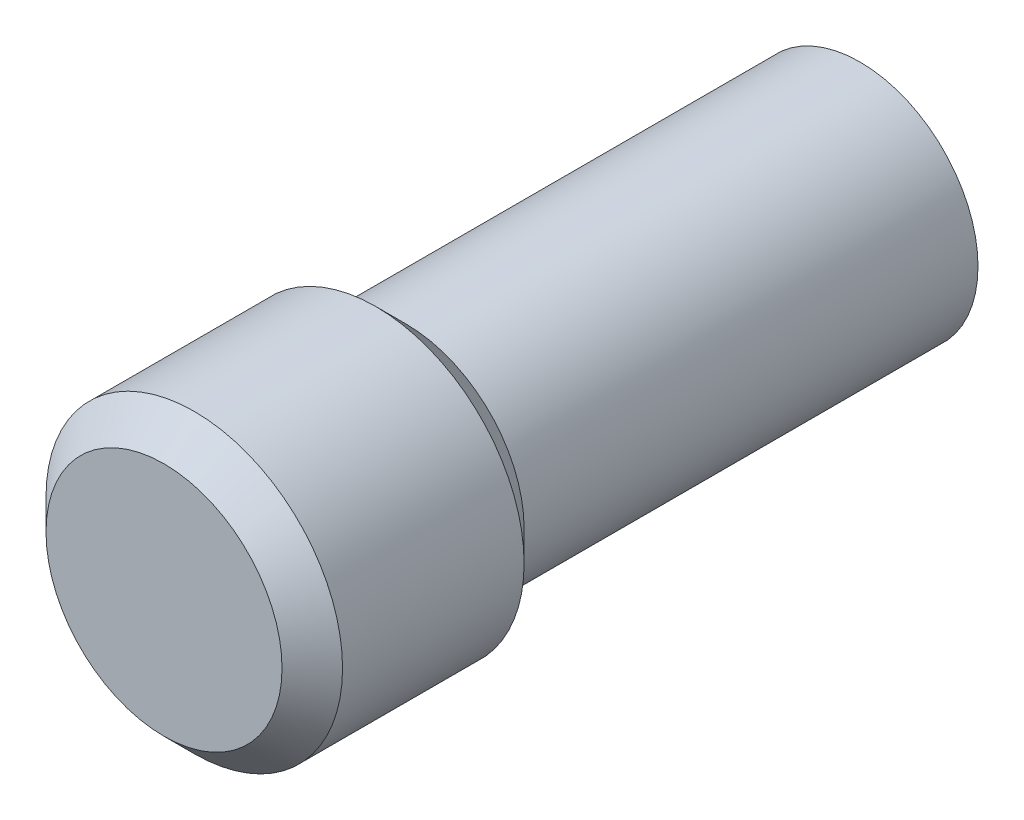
SolidWorks part; units mm, degrees
ref_plane "Front Plane" through (0, 0, 0) normal (0, 0, 1) x (1, 0, 0)
ref_plane "Top Plane" through (0, 0, 0) normal (0, 1, 0) x (1, 0, 0)
ref_plane "Right Plane" through (0, 0, 0) normal (1, 0, 0) x (0, 0, -1)
sketch "Sketch1" plane through (0, 0, 0) normal (0, 0, 1) x (1, 0, 0)
  circle A0 centre (0, 0) radius 3.9
  dimension "D1" = 7.8
extrude "Boss-Extrude1" add sketch "Sketch1" along normal blind 15
sketch "Sketch2" plane through (0, 0, 15) normal (0, 0, 1) x (1, 0, 0)
  circle A0 centre (0, 0) radius 4.9
  dimension "D1" = 9.8
extrude "Boss-Extrude2" add sketch "Sketch2" along normal blind 8
chamfer "Chamfer1" distance 1 angle 45 2 edges at (4.9, 0, 15) (4.9, 0, 23)
